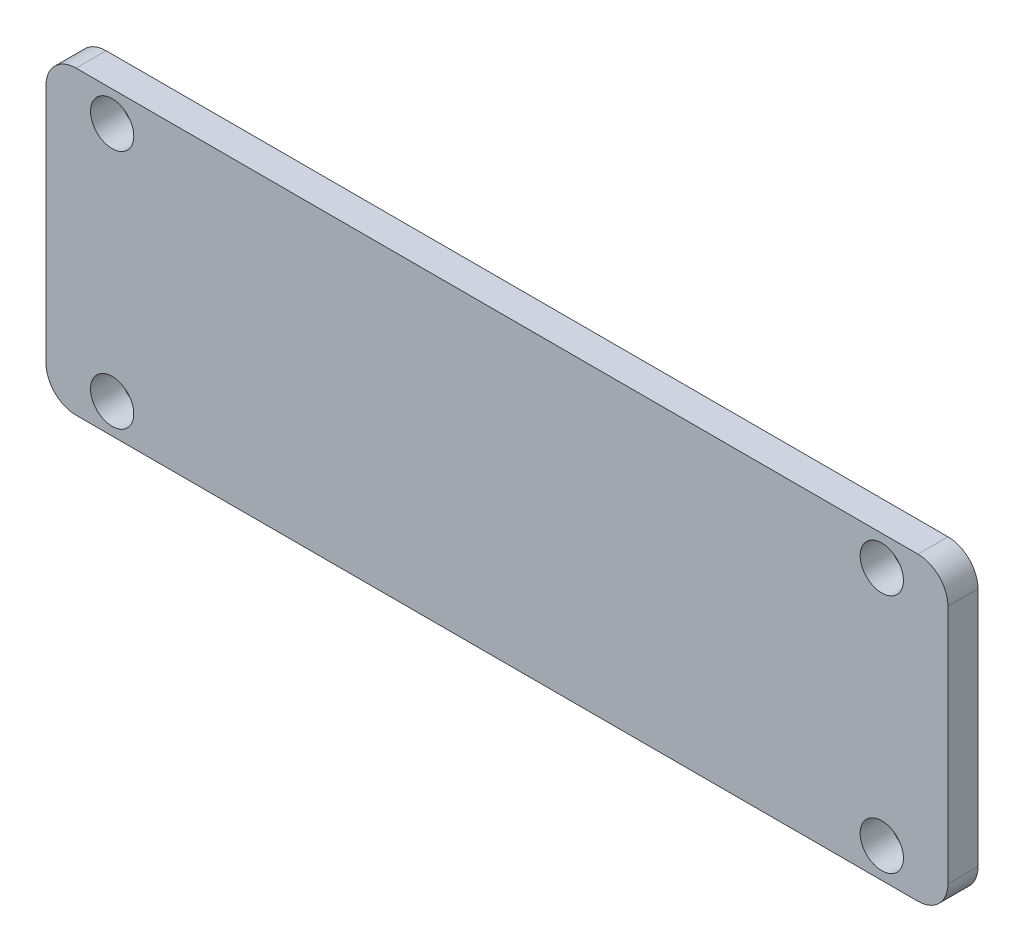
SolidWorks part; units mm, degrees
ref_plane "Front Plane" through (0, 0, 0) normal (0, 0, 1) x (1, 0, 0)
ref_plane "Top Plane" through (0, 0, 0) normal (0, 1, 0) x (1, 0, 0)
ref_plane "Right Plane" through (0, 0, 0) normal (1, 0, 0) x (0, 0, -1)
sketch "Sketch1" plane through (0, 0, 0) normal (0, 0, 1) x (1, 0, 0)
  line L0 (0, 62.9484) -> (0, -62.0383) construction
  line L1 (-47.625, 15.875) -> (47.625, 15.875)
  line L2 (-47.625, -15.875) -> (47.625, -15.875)
  line L4 (47.625, 15.875) -> (47.625, -15.875)
  line L5 (-92.9817, 0) -> (88.7345, 0) construction
  line L6 (-47.625, 15.875) -> (-47.625, -15.875)
  circle A0 centre (-40.64, 12.7) radius 2.286
  circle A1 centre (-40.64, -12.7) radius 2.286
  circle A2 centre (40.64, -12.7) radius 2.286
  circle A3 centre (40.64, 12.7) radius 2.286
  dimension "D3" = 4.572
  dimension "D4" = 40.64
  dimension "D1" = 95.25
  dimension "D2" = 31.75
  dimension "D5" = 25.4
extrude "Extrude1" add sketch "Sketch1" along normal blind 3.175
sketch "Sketch2" plane through (0, 0, 0) normal (0, 0, 1) x (1, 0, 0)
  line L0 (0, 33.7686) -> (0, -24.4531) construction
  line L1 (-15.875, 6.35) -> (15.875, 6.35)
  line L2 (-19.05, 3.175) -> (-19.05, -3.175)
  line L3 (52.6447, 0) -> (-54.851, 0) construction
  line L4 (-15.875, -6.35) -> (15.875, -6.35)
  line L5 (19.05, 3.175) -> (19.05, -3.175)
  arc A0 (-15.875, 6.35) -> (-19.05, 3.175) centre (-15.875, 3.175) ccw
  arc A1 (-19.05, -3.175) -> (-15.875, -6.35) centre (-15.875, -3.175) ccw
  arc A2 (19.05, -3.175) -> (15.875, -6.35) centre (15.875, -3.175) cw
  arc A3 (15.875, 6.35) -> (19.05, 3.175) centre (15.875, 3.175) cw
  point P10 (-19.05, 6.35)
  point P14 (-19.05, -6.35)
  point P17 (19.05, -6.35)
  point P20 (19.05, 6.35)
  dimension "D3" = 3.175
  dimension "D1" = 38.1
  dimension "D2" = 12.7
extrude "Cut-Extrude2" cut sketch "Sketch2" along normal blind 0.635
fillet "Fillet1" radius 3.175 4 edges at (-47.625, 15.875, 1.5875) (-47.625, -15.875, 1.5875) (47.625, -15.875, 1.5875) (47.625, 15.875, 1.5875)
